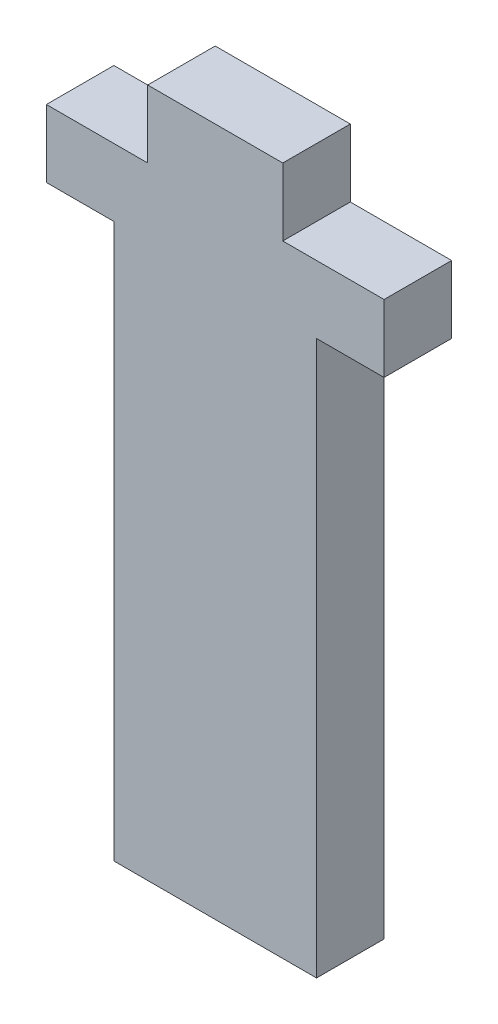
SolidWorks part; units mm, degrees
ref_plane "Plan de face" through (0, 0, 0) normal (0, 0, 1) x (1, 0, 0)
ref_plane "Plan de dessus" through (0, 0, 0) normal (0, 1, 0) x (1, 0, 0)
ref_plane "Plan de droite" through (0, 0, 0) normal (1, 0, 0) x (0, 0, -1)
sketch "Esquisse1" plane through (0, 0, 0) normal (0, 0, 1) x (1, 0, 0)
  line L1 (-12.5, 25.5) -> (12.5, 25.5)
  line L2 (-12.5, 25.5) -> (-12.5, -25.5)
  line L3 (-12.5, -25.5) -> (12.5, -25.5)
  line L4 (12.5, 25.5) -> (12.5, -25.5)
  line L5 (-12.5, 25.5) -> (12.5, -25.5) construction
  line L6 (-12.5, -25.5) -> (12.5, 25.5) construction
  point P0 (0, 0)
  dimension "D1" = 25
  dimension "D2" = 51
extrude "Boss.-Extru.1" add sketch "Esquisse1" along normal blind 5
sketch "Esquisse2" plane through (0, 0, 5) normal (0, 0, 1) x (1, 0, 0)
  line L1 (-12.5, 25.5) -> (-5, 25.5)
  line L2 (-12.5, 25.5) -> (-12.5, 20.5)
  line L3 (-12.5, 20.5) -> (-5, 20.5)
  line L4 (-5, 25.5) -> (-5, 20.5)
  line L5 (12.5, 25.5) -> (5, 25.5)
  line L6 (12.5, 25.5) -> (12.5, 20.5)
  line L7 (12.5, 20.5) -> (5, 20.5)
  line L8 (5, 25.5) -> (5, 20.5)
  dimension "D1" = 5
  dimension "D2" = 10
extrude "Enlèv. mat.-Extru.1" cut sketch "Esquisse2" against normal up to next
sketch "Esquisse3" plane through (0, 0, 5) normal (0, 0, 1) x (1, 0, 0)
  line L1 (-12.5, 15.5) -> (-7.5, 15.5)
  line L2 (-12.5, 15.5) -> (-12.5, -25.5)
  line L3 (-12.5, -25.5) -> (-7.5, -25.5)
  line L4 (-7.5, 15.5) -> (-7.5, -25.5)
  line L5 (12.5, 15.5) -> (7.5, 15.5)
  line L6 (12.5, 15.5) -> (12.5, -25.5)
  line L7 (12.5, -25.5) -> (7.5, -25.5)
  line L8 (7.5, 15.5) -> (7.5, -25.5)
  line L9 (-5, 20.5) -> (-5, 25.5) construction
  line L10 (12.5, -25.5) -> (12.5, 20.5) construction
  line L11 (-12.5, 20.5) -> (-5, 20.5) construction
  dimension "D1" = 5
extrude "Enlèv. mat.-Extru.2" cut sketch "Esquisse3" against normal up to next
sketch "Esquisse4" plane through (0, 0, 5) normal (0, 0, 1) x (1, 0, 0)
  line L0 (7.5, 15.5) -> (7.5, -25.5) construction
  line L3 (-7.5, -25.5) -> (7.5, -25.5) construction
  circle A0 centre (-4.5, -17.5) radius 1.5
  dimension "D2" = 3
  dimension "D3" = 8
  dimension "D1" = 12
extrude "Enlèv. mat.-Extru.3" [suppressed] cut sketch "Esquisse4" against normal up to next
